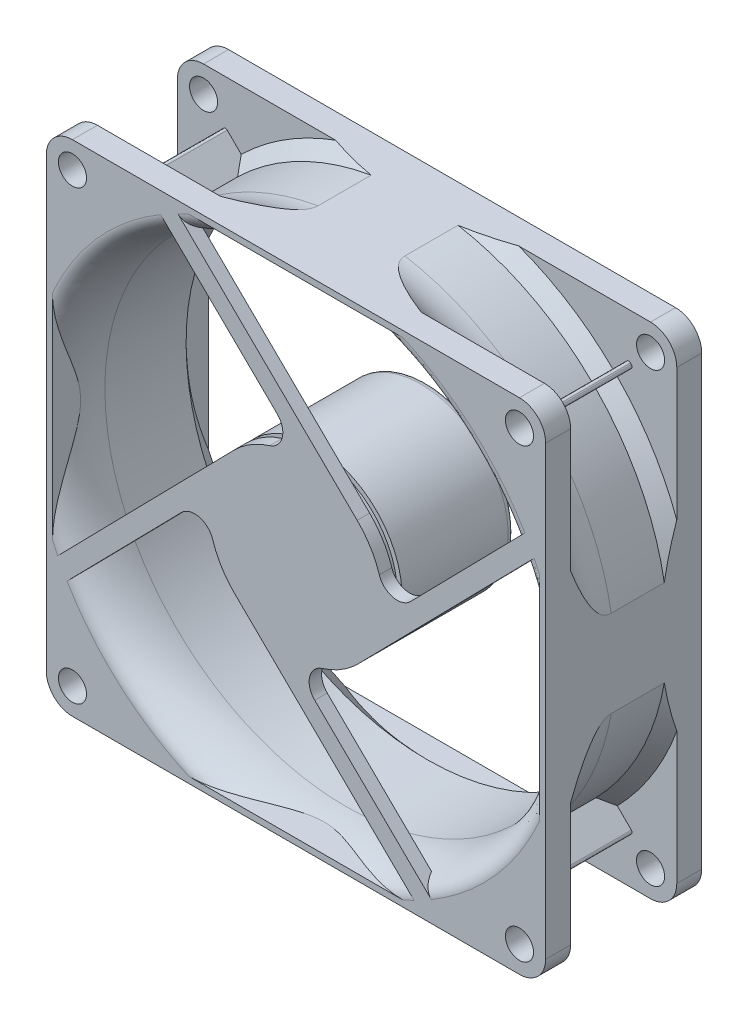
SolidWorks part; units mm, degrees
ref_plane "Front Plane" through (0, 0, 0) normal (0, 0, 1) x (1, 0, 0)
ref_plane "Top Plane" through (0, 0, 0) normal (0, 1, 0) x (1, 0, 0)
ref_plane "Right Plane" through (0, 0, 0) normal (1, 0, 0) x (0, 0, -1)
sketch "Sketch2" plane through (0, 0, 0) normal (0, 1, 0) x (1, 0, 0)
  line L0 (0, 0) -> (0, 34.545) construction
  line L1 (-38.6, 21) -> (-38.6, 0)
  line L4 (-40.6, 10.5) -> (-40.6, 19)
  line L7 (-42.6, 25) -> (-38.6, 21)
  line L8 (-42.6, 25) -> (-42.6, 21)
  line L9 (-42.6, 21) -> (-40.6, 19)
  line L10 (-38.6, 0) -> (-43.1, 0)
  line L11 (-43.1, 0) -> (-43.1, 4)
  spline S0 degree 3 poles (-40.6, 10.5) (-40.6, 7.9749) (-41.3382, 5.8092) (-43.1, 4) knots 0 0 0 0 1 1 1 1
  dimension "D1" = 40.6
  dimension "D2" = 77.2
  dimension "D3" = 45
  dimension "D4" = 4
  dimension "D5" = 2
  dimension "D6" = 2
  dimension "D7" = 2.5
  dimension "D8" = 6.5
  dimension "D9" = 4
  dimension "D10" = 4
  dimension "D11" = 25
revolve "Revolve1" add sketch "Sketch2" angle 360 about L0
sketch "Sketch3" plane through (0, 0, 0) normal (0, 0, 1) x (1, 0, 0)
  line L1 (-40, -40) -> (40, -40)
  line L2 (-40, -40) -> (-40, 40)
  line L3 (-40, 40) -> (40, 40)
  line L4 (40, -40) -> (40, 40)
  line L5 (-40, -40) -> (40, 40) construction
  line L6 (-40, 40) -> (40, -40) construction
  circle A0 centre (0, 0) radius 74.4746
  point P0 (0, 0)
  dimension "D1" = 80
  dimension "D2" = 80
extrude "Cut-Extrude1" cut sketch "Sketch3" against normal blind 30
sketch "Sketch4" plane through (0, 0, 0) normal (0, 0, 1) x (1, 0, 0)
  line L1 (-35.8, -40) -> (35.8, -40)
  line L2 (-40, -35.8) -> (-40, 35.8)
  line L3 (-35.8, 40) -> (35.8, 40)
  line L4 (40, -35.8) -> (40, 35.8)
  line L5 (-40, -40) -> (40, 40) construction
  line L6 (-40, 40) -> (40, -40) construction
  line L8 (-40, -16.0502) -> (-40, 16.0502) construction
  line L9 (-16.0502, 40) -> (16.0502, 40) construction
  circle A0 centre (0, 0) radius 39.2423
  arc A1 (-35.8, -40) -> (-40, -35.8) centre (-35.8, -35.8) cw
  arc A2 (35.8, -40) -> (40, -35.8) centre (35.8, -35.8) ccw
  arc A3 (35.8, 40) -> (40, 35.8) centre (35.8, 35.8) cw
  arc A4 (-40, 35.8) -> (-35.8, 40) centre (-35.8, 35.8) cw
  circle A5 centre (-35.8, 35.8) radius 2.25
  circle A6 centre (35.8, 35.8) radius 2.25
  circle A7 centre (35.8, -35.8) radius 2.25
  circle A8 centre (-35.8, -35.8) radius 2.25
  point P0 (0, 0)
  dimension "D3" = 4.2
  dimension "D1" = 4.5
  dimension "D2" = 4.5
  dimension "D4" = 4.5
  dimension "D5" = 4.5
extrude "Boss-Extrude1" add sketch "Sketch4" against normal blind 4 contours A4 L2 L3 M10 | A3 L3 L4 M8 | L1 A2 L4 M14 | A1 L1 L2 M12 | A0 M9 M10 M11 | A0 M7 M8 M9 | A0 M13 M14 M7 | A0 M11 M12 M13
ref_plane "Plane1" through (0, 0, -25) normal (0, 0, -1) x (-1, 0, 0)
sketch "Sketch5" plane through (0, 0, -25) normal (0, 0, -1) x (-1, 0, 0)
  line L0 (-16.0502, 40) -> (-35.8, 40) construction
  line L1 (35.8, -40) -> (-35.8, -40)
  line L2 (40, -35.8) -> (40, 35.8)
  line L3 (35.8, 40) -> (-35.8, 40)
  line L4 (-40, -35.8) -> (-40, 35.8)
  line L5 (40, -40) -> (-40, 40) construction
  line L6 (40, 40) -> (-40, -40) construction
  line L7 (-40, 16.0502) -> (-40, 35.8) construction
  line L9 (39, -39) -> (-39, -39)
  line L10 (39, -39) -> (39, 39)
  line L11 (39, 39) -> (-39, 39)
  line L12 (-39, -39) -> (-39, 39)
  line L13 (39, -39) -> (-39, 39) construction
  line L14 (39, 39) -> (-39, -39) construction
  arc A0 (-35.8, -40) -> (-40, -35.8) centre (-35.8, -35.8) cw
  arc A1 (35.8, -40) -> (40, -35.8) centre (35.8, -35.8) ccw
  arc A2 (40, 35.8) -> (35.8, 40) centre (35.8, 35.8) ccw
  arc A3 (-35.8, 40) -> (-40, 35.8) centre (-35.8, 35.8) ccw
  circle A4 centre (0, 0) radius 42.6
  circle A5 centre (-35.8, -35.8) radius 2.25
  circle A6 centre (-35.8, 35.8) radius 2.25
  circle A7 centre (35.8, 35.8) radius 2.25
  circle A8 centre (35.8, -35.8) radius 2.25
  point P0 (0, 0)
  point P22 (0, 0)
  dimension "D1" = 4.2
  dimension "D3" = 4.5
  dimension "D4" = 4.5
  dimension "D5" = 4.5
  dimension "D6" = 4.5
  dimension "D2" = 1
extrude "Boss-Extrude2" add sketch "Sketch5" against normal blind 4 contours A4 L3 A3 L11 | A4 L11 A3 L12 | A4 L12 A3 L4 | L11 A4 L3 | L12 A4 L4 | A4 L11 A2 L3 | A4 L10 A2 L11 | A4 L2 A2 L10 | L2 A4 L10 | A4 L9 A1 L10 | A4 L10 A1 L2 | A4 L1 A1 L9 | L9 A4 L1 | A4 L12 A0 L9 | A4 L4 A0 L12 | A4 L9 A0 L1
fillet "Fillet1" radius 8 1 edges at (38.6, 0, 0)
sketch "Sketch6" plane through (0, 0, 0) normal (0, 0, 1) x (1, 0, 0)
  line L0 (-35.8, 40) -> (-14.6545, 40) construction
  line L1 (39, -39) -> (-39, -39)
  line L2 (39, -39) -> (39, 39)
  line L3 (39, 39) -> (-39, 39)
  line L4 (-39, -39) -> (-39, 39)
  line L5 (39, -39) -> (-39, 39) construction
  line L6 (39, 39) -> (-39, -39) construction
  line L7 (40, -40) -> (-40, -40)
  line L8 (40, -40) -> (40, 40)
  line L9 (40, 40) -> (-40, 40)
  line L10 (-40, -40) -> (-40, 40)
  line L11 (40, -40) -> (-40, 40) construction
  line L12 (40, 40) -> (-40, -40) construction
  line L13 (-40, 14.6545) -> (-40, 35.8) construction
  point P0 (0, 0)
  point P6 (0, 0)
  dimension "D1" = 1
  dimension "D2" = 1
extrude "Boss-Extrude4" add sketch "Sketch6" against normal up to surface
sketch "Sketch7" plane through (0, 0, 0) normal (0, 0, 1) x (1, 0, 0)
  line L0 (-9.9949, 9.8032) -> (-38.8258, -19.5916)
  line L1 (-38.8258, -19.5916) -> (-37.7042, -22.7323)
  line L2 (-37.7042, -22.7323) -> (-13.9173, 1.5198)
  line L3 (-22.7323, 37.7042) -> (1.5198, 13.9173)
  line L4 (9.8032, 9.9949) -> (-19.5916, 38.8258)
  line L5 (-19.5916, 38.8258) -> (-22.7323, 37.7042)
  line L6 (37.7042, 22.7323) -> (13.9173, -1.5198)
  line L7 (9.9949, -9.8032) -> (38.8258, 19.5916)
  line L8 (38.8258, 19.5916) -> (37.7042, 22.7323)
  line L9 (22.7323, -37.7042) -> (-1.5198, -13.9173)
  line L10 (-9.8032, -9.9949) -> (19.5916, -38.8258)
  line L11 (19.5916, -38.8258) -> (22.7323, -37.7042)
  circle A0 centre (0, 0) radius 14
  point P22 (0, 0)
  dimension "D1" = 28
  dimension "D2" = 3
  dimension "D3" = 4
extrude "Boss-Extrude5" add sketch "Sketch7" against normal blind 2
sketch "Sketch8" plane through (0, 0, -2) normal (0, 0, -1) x (-1, 0, 0)
  circle A0 centre (0, 0) radius 13.2382
extrude "Boss-Extrude6" add sketch "Sketch8" along normal blind 1
sketch "Sketch9" plane through (0, 0, -3) normal (0, 0, -1) x (-1, 0, 0)
  circle A0 centre (0, 0) radius 14
  dimension "D1" = 28
extrude "Boss-Extrude7" add sketch "Sketch9" along normal blind 18
fillet "Fillet2" radius 1 1 edges at (-14, 0, -21)
fillet "Fillet3" radius 3 4 edges at (-1.5198, -13.9173, -1) (-13.9173, 1.5198, -1) (13.9173, -1.5198, -1) (1.5198, 13.9173, -1)
sketch "Sketch10" plane through (0, 0, -4) normal (0, 0, -1) x (-1, 0, 0)
  line L0 (0, 0) -> (-35.8, 35.8) construction
  line L1 (-32.2929, 33) -> (-33, 32.2929)
  line L2 (-33, 32.2929) -> (-28.6378, 27.9307)
  line L3 (-28.6378, 27.9307) -> (-27.9307, 28.6378)
  line L4 (-27.9307, 28.6378) -> (-32.2929, 33)
  line L5 (28.6378, 27.9307) -> (33, 32.2929)
  line L6 (33, 32.2929) -> (32.2929, 33)
  line L7 (32.2929, 33) -> (27.9307, 28.6378)
  line L8 (27.9307, 28.6378) -> (28.6378, 27.9307)
  line L9 (27.9307, -28.6378) -> (32.2929, -33)
  line L10 (32.2929, -33) -> (33, -32.2929)
  line L11 (33, -32.2929) -> (28.6378, -27.9307)
  line L12 (28.6378, -27.9307) -> (27.9307, -28.6378)
  line L13 (-28.6378, -27.9307) -> (-33, -32.2929)
  line L14 (-33, -32.2929) -> (-32.2929, -33)
  line L15 (-32.2929, -33) -> (-27.9307, -28.6378)
  line L16 (-27.9307, -28.6378) -> (-28.6378, -27.9307)
  line L17 (-40, 16.0502) -> (-40, 35.8) construction
  point P23 (0, 0)
  dimension "D1" = 1
  dimension "D2" = 0.5
  dimension "D4" = 7
  dimension "D5" = 40
  dimension "D3" = 4
extrude "Boss-Extrude9" add sketch "Sketch10" along normal blind 18
fillet "Fillet4" radius 0.4 8 edges at (-33, 32.2929, -12.5) (-32.2929, 33, -12.5) (-33, -32.2929, -12.5) (-32.2929, -33, -12.5) (33, -32.2929, -12.5) (32.2929, -33, -12.5) (33, 32.2929, -12.5) (32.2929, 33, -12.5)
